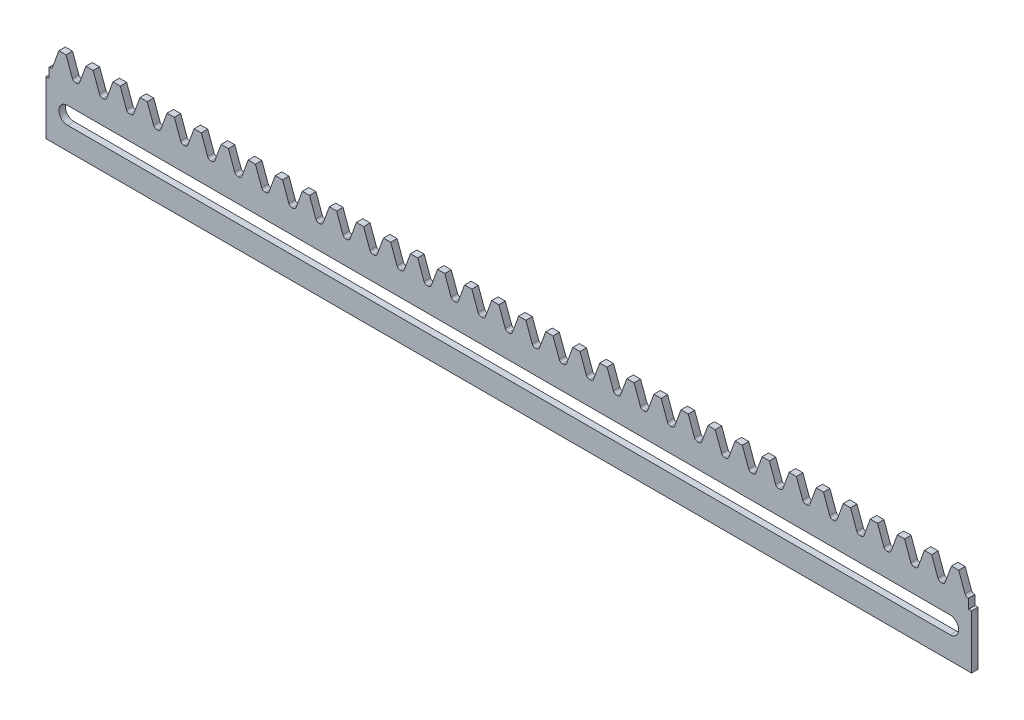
SolidWorks part; units mm, degrees
ref_plane "Plan median" through (0, 0, 0) normal (0, 0, 1) x (1, 0, 0)
ref_plane "Plan2" through (0, 0, 0) normal (0, 1, 0) x (1, 0, 0)
ref_plane "Plan3" through (0, 0, 0) normal (1, 0, 0) x (0, 0, -1)
sketch "Esquisse1" plane through (0, 0, 0) normal (0, 0, 1) x (1, 0, 0)
  line L0 (0, 0) -> (6.2832, 0) construction
  line L1 (1.4556, 4) -> (-1.4555, -3.9998)
  line L2 (1.4556, 4) -> (4.8276, 4)
  line L3 (4.8276, 4) -> (7.7387, -3.9998)
  line L4 (0, 0) -> (0, 4) construction
  line L5 (9.1671, -5) -> (9.4248, -5)
  line L6 (-2.8839, -5) -> (-3.1416, -5)
  line L7 (9.4248, -5) -> (9.4248, 7.1416)
  line L8 (-3.1416, -5) -> (-3.1416, 7.1416)
  line L9 (-3.1416, 7.1416) -> (9.4248, 7.1416)
  arc A0 (7.7387, -3.9998) -> (9.1671, -5) centre (9.1671, -3.48) ccw
  arc A1 (-2.8839, -5) -> (-1.4555, -3.9998) centre (-2.8839, -3.48) ccw
  point P14 (-1.8195, -5)
ref_plane "Plan4" through (-3.1416, 0, 0) normal (1, 0, 0) x (0, 0, -1)
sketch "Section Cremaillere" plane through (-3.1416, 0, 0) normal (1, 0, 0) x (0, 0, -1)
  line L1 (-1.5, 7.1416) -> (1.5, 7.1416)
  line L2 (-1.5, 7.1416) -> (-1.5, -9.42)
  line L3 (-1.5, -9.42) -> (1.5, -9.42)
  line L4 (1.5, 7.1416) -> (1.5, -9.42)
  line L5 (0, -9.42) -> (0, 7.1416) construction
  line L6 (0, 50) -> (0, -50) construction
  dimension "L" = 3
  dimension "h" = 9.42
extrude "Base-Extrusion" add sketch "Section Cremaillere" along normal blind 427.2566
extrude "Enlèv. mat.-Extru.2" cut sketch "Esquisse1" against normal through all and the other way blind 100
pattern_linear "Répétition linéaire1" count 34 spacing 12.5664 along (1, 0, 0) of "Enlèv. mat.-Extru.2"
sketch "Esquisse2" plane through (-3.1416, 0, 0) normal (-1, 0, 0) x (0, 0, 1)
  line L0 (0, 0) -> (-1.5, 0)
  line L1 (0, 0) -> (1.5, 0)
  line L2 (-1.5, -5) -> (1.5, -5) construction
  line L3 (-1.5, -5) -> (1.5, -5)
  line L4 (-1.5, 7.1416) -> (-1.5, -9.42) construction
  line L5 (1.5, 7.1416) -> (1.5, -9.42) construction
  line L6 (-1.5, 0) -> (-1.5, -5)
  line L7 (1.5, 0) -> (1.5, -5)
extrude "Plan primitif" [suppressed] add sketch "Esquisse2" along normal up to surface (188.4956 mm away)
sketch "Gravure droite" plane through (0, 0, 1.5) normal (0, 0, 1) x (1, 0, 0)
  line L0 (-3.1416, 0) -> (424.115, 0)
  line L1 (-3.1416, -5) -> (-3.1416, -9.42) construction
  line L2 (424.115, -5) -> (424.115, -9.42) construction
sketch "Esquisse3" plane through (0, 0, 1.5) normal (0, 0, 1) x (1, 0, 0)
  line L0 (210.4867, -9.42) -> (210.4867, -122.0486) construction
  line L1 (424.115, -9.42) -> (-3.1416, -9.42) construction
  line L2 (5.4867, -20) -> (415.4867, -20) construction
  line L3 (-4.5133, -34.42) -> (425.4867, -34.42)
  line L4 (-4.5133, -34.42) -> (-4.5133, -9.42)
  line L5 (-4.5133, -9.42) -> (425.4867, -9.42)
  line L6 (425.4867, -34.42) -> (425.4867, -9.42)
  line L7 (-4.5133, -34.42) -> (425.4867, -9.42) construction
  line L8 (-4.5133, -9.42) -> (425.4867, -34.42) construction
  line L9 (5.4867, -16) -> (415.4867, -16)
  line L10 (5.4867, -24) -> (415.4867, -24)
  line L11 (-3.1416, 0) -> (424.115, 0) construction
  arc A0 (5.4867, -16) -> (5.4867, -24) centre (5.4867, -20) ccw
  arc A1 (415.4867, -24) -> (415.4867, -16) centre (415.4867, -20) ccw
  point P5 (210.4867, -21.92)
  point P11 (210.4867, -20)
  dimension "D3" = 4
  dimension "D1" = 430
  dimension "D2" = 25
  dimension "D4" = 410
  dimension "D5" = 20
extrude "Boss.-Extru.1" add sketch "Esquisse3" against normal through all
equation "\"LD@Esquisse1\" = \"m@Esquisse1\"*1.570796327"
equation "\"FD@Esquisse1\"=\"m@Esquisse1\"*1.25"
equation "\"DLD@Esquisse1\"=\"LD@Esquisse1\"/2"
equation "\"R1@Esquisse1\"=\"m@Esquisse1\"*0.38"
equation "\"D1@Base-Extrusion\"=\"LD@Esquisse1\"*2*\"Nd@Répétition linéaire1\""
equation "\"D3@Répétition linéaire1\"=\"LD@Esquisse1\"*2"
